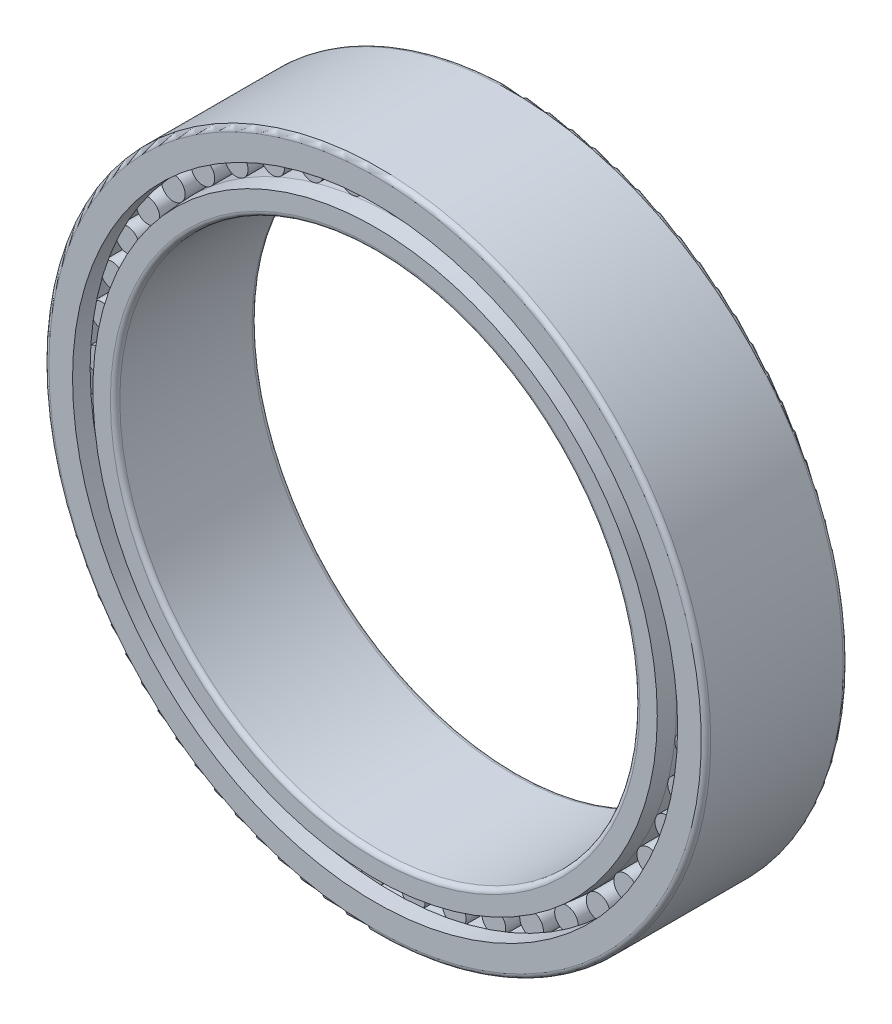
SolidWorks part; units mm, degrees
ref_plane "Front Plane" through (0, 0, 0) normal (0, 0, 1) x (1, 0, 0)
ref_plane "Top Plane" through (0, 0, 0) normal (0, 1, 0) x (1, 0, 0)
ref_plane "Right Plane" through (0, 0, 0) normal (1, 0, 0) x (0, 0, -1)
sketch "BaseSke" plane through (0, 0, 0) normal (1, 0, 0) x (0, 0, -1)
  line L0 (-47.2296, 0) -> (24.6132, 0) construction
  line L1 (-47.2296, 62.5) -> (24.6132, 62.5) construction
  line L2 (0, 129.5214) -> (0, -86.3012) construction
  line L3 (-11.25, 62.5) -> (-11.25, 65) construction
  line L4 (-15, 70) -> (15, 70) construction
  line L5 (-15, 55) -> (15, 55) construction
  line L6 (-11.25, 60) -> (11.25, 60)
  line L7 (-11.25, 60) -> (-11.25, 62.5)
  line L8 (-11.25, 62.5) -> (11.25, 62.5)
  line L9 (11.25, 60) -> (11.25, 62.5)
  line L10 (-11.25, 65) -> (11.25, 65) construction
  line L11 (11.25, 65) -> (11.25, 62.5) construction
  dimension "D2" = 22.5
  dimension "D1" = 125
  dimension "Bearing_Thickness" = 30
  dimension "Bearing_Outside_Diameter" = 140
  dimension "Bearing_Inside_Diameter" = 110
  dimension "Diameter_Fw" = 120
revolve "Roller" add sketch "BaseSke" angle 360 about L8
sketch "OuterRaceSke" plane through (0, 0, 0) normal (1, 0, 0) x (0, 0, -1)
  line L0 (0, 0) -> (0, 87.5396) construction
  line L1 (-15, 70) -> (15, 70)
  line L2 (-15, 70) -> (-15, 64)
  line L3 (-15, 64) -> (-11.275, 64)
  line L4 (15, 70) -> (15, 64)
  line L5 (-50.3916, 0) -> (55.2197, 0) construction
  line L6 (-11.25, 65) -> (11.25, 65) construction
  line L7 (11.275, 64) -> (15, 64)
  line L9 (-11.275, 64) -> (-11.275, 64.98)
  line L10 (-11.275, 64.98) -> (11.275, 64.98)
  line L11 (11.275, 64) -> (11.275, 64.98)
  dimension "D1" = 22.55
  dimension "D2" = 128
  dimension "D3" = 0.02
revolve "OuterRace" add sketch "OuterRaceSke" angle 360 about L5
sketch "InnerRaceSke" plane through (0, 0, 0) normal (1, 0, 0) x (0, 0, -1)
  line L0 (-70.8626, 0) -> (113.5527, 0) construction
  line L1 (0, 58.441) -> (0, -70.8113) construction
  line L2 (-15, 55) -> (15, 55)
  line L3 (-15, 55) -> (-15, 59.6941)
  line L5 (-11.275, 60.02) -> (-15, 59.6941)
  line L6 (0, 129.5214) -> (0, -86.3012) construction
  line L7 (-11.275, 60.02) -> (11.275, 60.02)
  line L9 (15, 55) -> (15, 59.6941)
  line L10 (11.275, 60.02) -> (15, 59.6941)
  line L13 (-11.25, 60) -> (11.25, 60) construction
  point P17 (0, 55)
  dimension "D2" = 0.02
  dimension "D1" = 22.55
  dimension "D3" = 5
revolve "InnerRace" add sketch "InnerRaceSke" angle 360 about L0
fillet "Fillet1" radius 1 4 edges at (55, 0, 15) (70, 0, -15) (70, 0, 15) (55, 0, -15)
pattern_circular "CirPatternBall" count 45 over 360 about axis through (0, 0, 0) along (0, 0, 1) of "Roller"
sketch "SimplifiedSke" plane through (0, 0, 0) normal (1, 0, 0) x (0, 0, -1)
  line L0 (37.5911, 0) -> (-37.5911, 0) construction
  line L1 (-13.1351, 62.5) -> (13.151, 62.5) construction
  line L2 (-11.25, 65) -> (11.25, 65)
  line L3 (-11.25, 65) -> (-11.25, 60)
  line L4 (-11.25, 60) -> (11.25, 60)
  line L5 (11.25, 65) -> (11.25, 60)
  line L6 (-47.2296, 62.5) -> (24.6132, 62.5) construction
revolve "Simplified" [suppressed] add sketch "SimplifiedSke" angle 360 about L0
equation "\"D2@BaseSke\" = \"Bearing_Thickness@BaseSke\"*0.75"
equation "\"D1@BaseSke\" =  ( \"Bearing_Outside_Diameter@BaseSke\" + \"Bearing_Inside_Diameter@BaseSke\" )  / 2"
equation "\"D1@OuterRaceSke\" = \"Bearing_Thickness@BaseSke\"*0.75+0.05"
equation "\"D2@OuterRaceSke\" =\"Bearing_Outside_Diameter@BaseSke\" -  ( \"Bearing_Outside_Diameter@BaseSke\" - \"Bearing_Inside_Diameter@BaseSke\"  )/ 2.5 "
equation "\"D1@InnerRaceSke\" = \"Bearing_Thickness@BaseSke\"*0.75+0.05"
equation "\"D1@CirPatternBall\" =  int(  ( \"Bearing_Outside_Diameter@BaseSke\" + \"Bearing_Inside_Diameter@BaseSke\" )  / 2 *  pi  /  ( \"Bearing_Outside_Diameter@BaseSke\" - \"Bearing_Inside_Diameter@BaseSke\" ) * 3.5 "
